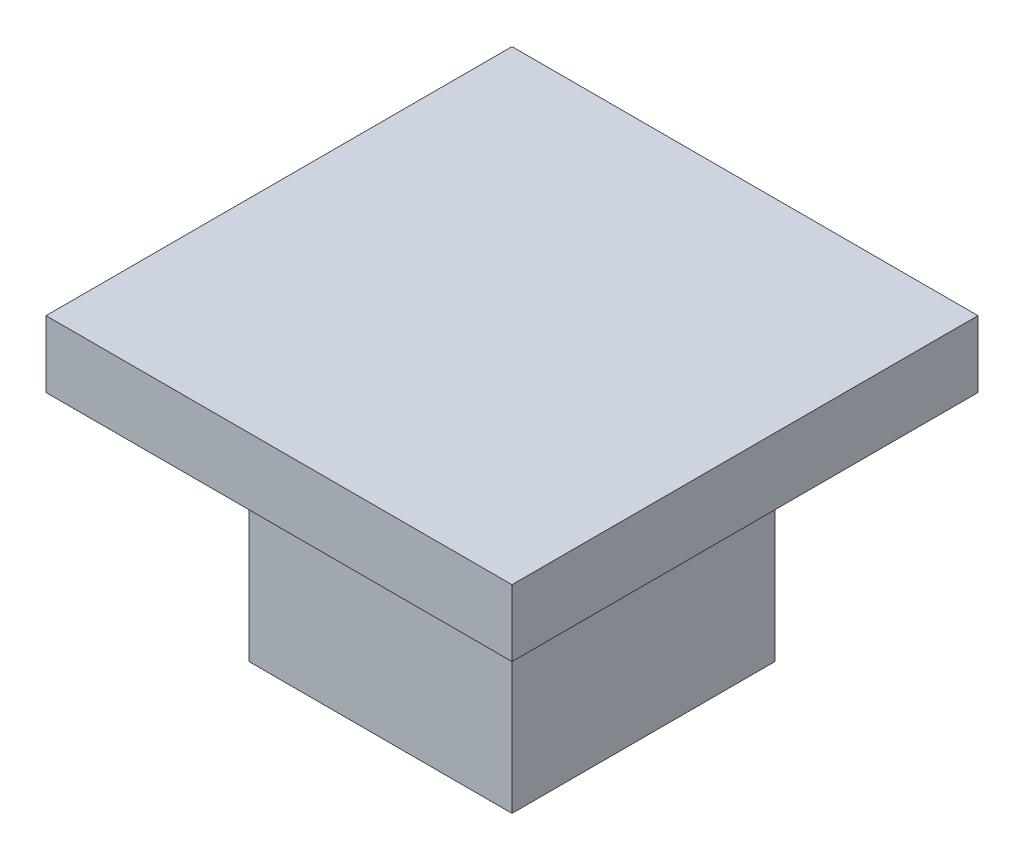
SolidWorks part; units mm, degrees
ref_plane "Plan de face" through (0, 0, 0) normal (0, 0, 1) x (1, 0, 0)
ref_plane "Plan de dessus" through (0, 0, 0) normal (0, 1, 0) x (1, 0, 0)
ref_plane "Plan de droite" through (0, 0, 0) normal (1, 0, 0) x (0, 0, -1)
sketch "Esquisse1" plane through (0, 0, 0) normal (0, 1, 0) x (1, 0, 0)
  line L1 (-3.95, 3.95) -> (3.95, 3.95)
  line L2 (-3.95, 3.95) -> (-3.95, -3.95)
  line L3 (-3.95, -3.95) -> (3.95, -3.95)
  line L4 (3.95, 3.95) -> (3.95, -3.95)
  line L5 (-3.95, 3.95) -> (3.95, -3.95) construction
  line L6 (-3.95, -3.95) -> (3.95, 3.95) construction
  line L11 (-2.75, 2.75) -> (2.95, -2.95) construction
  line L12 (-2.85, -2.85) -> (2.85, 2.85) construction
  point P0 (0, 0)
  point P5 (0, 0)
  dimension "D1" = 7.9
  dimension "D2" = 7.9
extrude "Boss.-Extru.1" add sketch "Esquisse1" along normal blind 7
sketch "Esquisse4" plane through (0, 7, 0) normal (0, 1, 0) x (1, 0, 0)
  line L1 (-7, 7) -> (7, 7)
  line L2 (-7, 7) -> (-7, -7)
  line L3 (-7, -7) -> (7, -7)
  line L4 (7, 7) -> (7, -7)
  line L5 (-7, 7) -> (7, -7) construction
  line L6 (-7, -7) -> (7, 7) construction
  point P0 (0, 0)
  dimension "D1" = 14
  dimension "D2" = 14
extrude "Boss.-Extru.2" add sketch "Esquisse4" along normal blind 2
